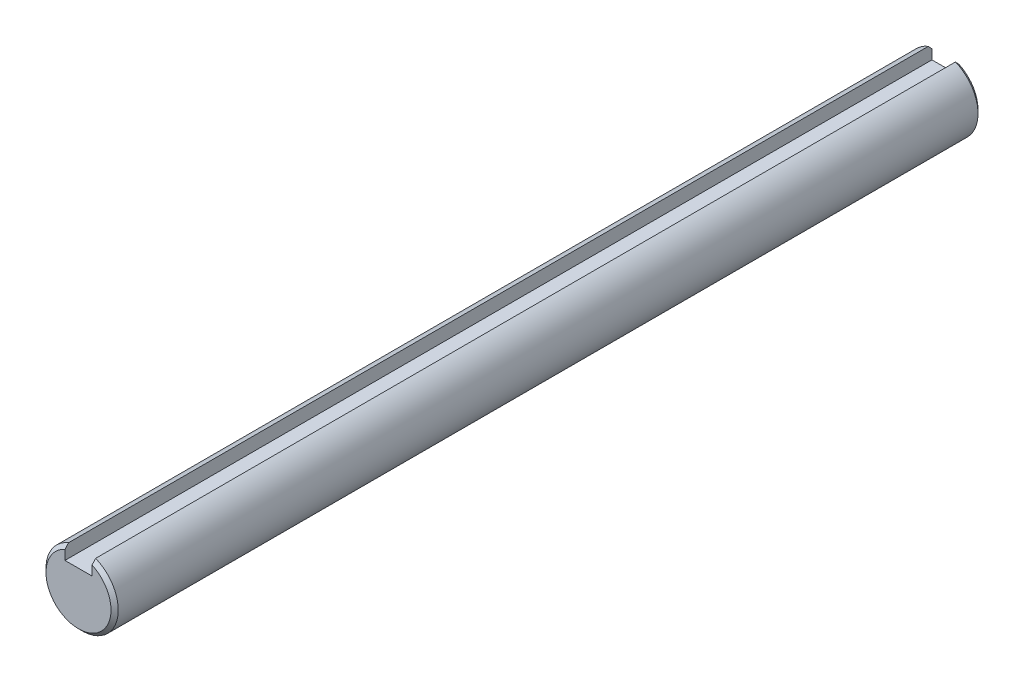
SolidWorks part; units mm, degrees
ref_plane "Front Plane" through (0, 0, 0) normal (0, 0, 1) x (1, 0, 0)
ref_plane "Top Plane" through (0, 0, 0) normal (0, 1, 0) x (1, 0, 0)
ref_plane "Right Plane" through (0, 0, 0) normal (1, 0, 0) x (0, 0, -1)
sketch "Sketch1" plane through (0, 0, 0) normal (0, 0, 1) x (1, 0, 0)
  line L0 (-2.2451, -2.2451) -> (-1.1225, -1.1225) construction
  line L1 (3.4925, 0) -> (-3.4925, 0) construction
  line L2 (0, 0) -> (0, 3.175) construction
  line L4 (-1.1906, 3.175) -> (1.1906, 3.175) construction
  line L5 (-1.1906, 3.175) -> (-1.1906, 1.7527) construction
  line L6 (-1.1906, 1.7527) -> (1.1906, 1.7527) construction
  line L7 (1.1906, 3.175) -> (1.1906, 1.7527) construction
  line L8 (-1.1906, 3.175) -> (1.1906, 1.7527) construction
  line L9 (-1.1906, 1.7527) -> (1.1906, 3.175) construction
  circle A0 centre (0, 0) radius 1.5875 construction
  circle A1 centre (0, 0) radius 3.175 construction
  point P6 (0, 2.4638)
  point P16 (-1.1906, 2.9433)
sketch "Sketch2" plane through (0, 0, 0) normal (1, 0, 0) x (0, 0, -1)
  line L0 (-38.1, -3.175) -> (38.1, -3.175) construction
  line L1 (0, 3.175) -> (0, -3.175) construction
  line L2 (0, 3.175) -> (0, -3.175) construction
  point P3 (25.4, -3.175)
  point P4 (-25.4, -3.175)
sketch "Sketch3" plane through (0, 0, 0) normal (0, 0, 1) x (1, 0, 0)
  circle A1 centre (0, 0) radius 3.175 construction
  circle A3 centre (0, 0) radius 3.175
extrude "Boss-Extrude2" add sketch "Sketch3" along normal up to vertex (38.1 mm away) and the other way up to vertex (38.1 mm away)
sketch "Sketch10" plane through (0, 0, 0) normal (0, 0, 1) x (1, 0, 0)
  line L1 (1.1906, 3.175) -> (1.1906, 1.7527) construction
  line L2 (-1.1906, 1.7527) -> (1.1906, 1.7527) construction
  line L3 (-1.1906, 3.175) -> (-1.1906, 1.7527) construction
  line L4 (-1.1906, 3.175) -> (1.1906, 3.175) construction
  line L5 (1.1906, 3.175) -> (1.1906, 1.7527)
  line L6 (-1.1906, 1.7527) -> (1.1906, 1.7527)
  line L7 (-1.1906, 3.175) -> (-1.1906, 1.7527)
  line L8 (-1.1906, 3.175) -> (1.1906, 3.175)
extrude "Cut-Extrude5" cut sketch "Sketch10" against normal through all both and the other way through all
chamfer "Chamfer1" distance 0.3175 angle 45 2 edges at (0, -3.175, 38.1) (0, -3.175, -38.1)
equation "\"D1@Chamfer1\"= \"Diameter@Sketch1\" / 20"
equation "\"D1@Sketch2\"=\"Diameter@Sketch1\"*2"
equation "\"D2@Sketch2\"=\"D1@Sketch2\""
